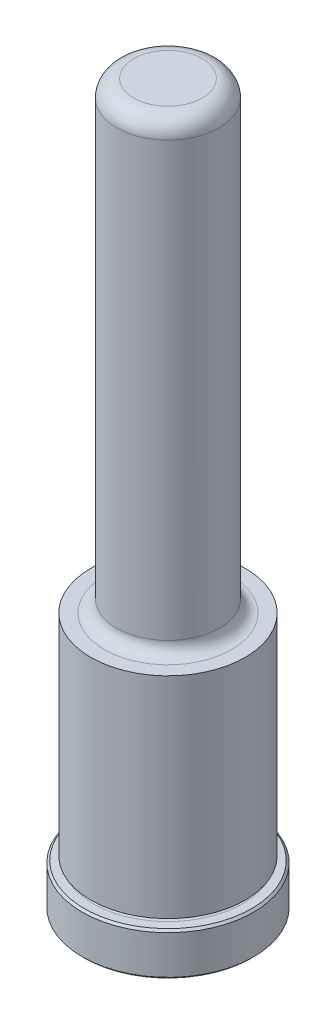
SolidWorks part; units mm, degrees
ref_plane "Front Plane" through (0, 0, 0) normal (0, 0, 1) x (1, 0, 0)
ref_plane "Top Plane" through (0, 0, 0) normal (0, 1, 0) x (1, 0, 0)
ref_plane "Right Plane" through (0, 0, 0) normal (1, 0, 0) x (0, 0, -1)
sketch "Sketch1" plane through (0, 0, 0) normal (1, 0, 0) x (0, 0, -1)
  line L0 (0, 0) -> (15.875, 0)
  line L1 (15.875, 0) -> (15.875, 7.9248)
  line L2 (15.875, 7.9248) -> (13.8938, 7.9248)
  line L3 (13.5128, 2.6782) -> (13.5128, 5.9795) construction
  line L4 (13.8938, 8.6868) -> (14.3002, 8.6868)
  line L5 (14.3002, 8.6868) -> (14.3002, 47.625)
  line L6 (14.3002, 47.625) -> (11.7983, 47.625)
  line L7 (9.5123, 49.911) -> (9.5123, 133.35)
  line L9 (9.5123, 133.35) -> (0, 133.35)
  line L10 (0, 133.35) -> (0, 0)
  line L11 (0, 0) -> (0, -7.2694) construction
  arc A0 (13.8938, 8.6868) -> (13.8938, 7.9248) centre (13.8938, 8.3058) ccw
  arc A1 (11.7983, 47.625) -> (9.5123, 49.911) centre (11.7983, 49.911) cw
  point P2 (9.5123, 133.35)
  point P14 (9.5123, 133.0685)
  point P19 (9.5123, 47.625)
  dimension "D14" = 0.762
  dimension "D8" = 2.286
  dimension "T" = 7.9248
  dimension "D2" = 0.762
  dimension "M" = 31.75
  dimension "B" = 28.6004
  dimension "L" = 133.35
  dimension "D7" = 0.7874
  dimension "A" = 47.625
  dimension "D" = 19.0246
  dimension "D15" = 85.725
revolve "Revolve1" add sketch "Sketch1" angle 360 about L11
chamfer "Chamfer1" distance 0.381 angle 45 2 edges at (0, 0, 15.875) (0, 7.9248, 15.875)
fillet "Fillet1" radius 3.175 1 edges at (0, 133.35, 9.5123)
